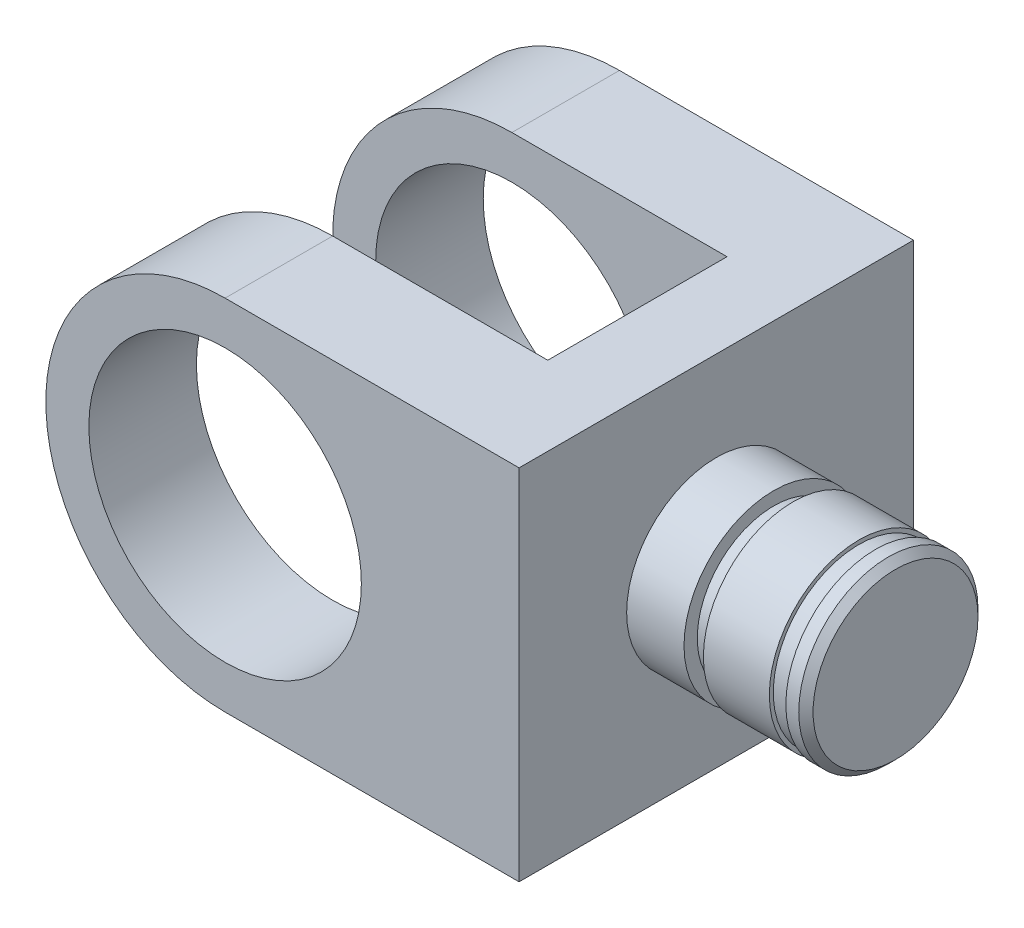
SolidWorks part; units mm, degrees
ref_plane "Face" through (0, 0, 0) normal (0, 0, 1) x (1, 0, 0)
ref_plane "Dessus" through (0, 0, 0) normal (0, 1, 0) x (1, 0, 0)
ref_plane "Droite" through (0, 0, 0) normal (1, 0, 0) x (0, 0, -1)
sketch "Esquisse1" plane through (0, 0, 0) normal (0, 0, 1) x (1, 0, 0)
  line L0 (-15.3524, 22.807) -> (-7.3524, 22.807)
  line L1 (9.6476, 10.307) -> (9.6476, 21.807)
  line L2 (21.1095, 10.307) -> (-49.652, 10.307) construction
  line L3 (-15.3524, 22.807) -> (-15.3524, 10.307)
  line L4 (6.8476, 22.807) -> (8.6476, 22.807)
  line L5 (9.6476, 21.807) -> (8.6476, 22.807)
  line L6 (4.5476, 22.807) -> (4.5476, 22.257)
  line L7 (4.5476, 22.257) -> (6.8476, 22.257)
  line L8 (6.8476, 22.807) -> (6.8476, 22.257)
  line L9 (9.6476, 10.307) -> (-15.3524, 10.307)
  line L10 (-4.6524, 22.807) -> (4.5476, 22.807)
  line L12 (-7.3524, 22.807) -> (-7.3524, 20.957)
  line L13 (-7.3524, 20.957) -> (-4.6524, 20.957)
  line L14 (-4.6524, 22.807) -> (-4.6524, 20.957)
  point P1 (9.6476, 22.807)
  dimension "D1" = 2.7
  dimension "D2" = 25
  dimension "D3" = 23.9
  dimension "D4" = 22.2
  dimension "D5" = 25
  dimension "D7" = 1
  dimension "D6" = 21.3
  dimension "D8" = 8
revolve "Révolution1" add sketch "Esquisse1" angle 360 about L2
sketch "Esquisse2" plane through (0, 0, 0) normal (0, 0, 1) x (1, 0, 0)
  line L0 (-15.3524, 22.807) -> (-15.3524, -2.193) construction
  line L1 (-56.3524, 35.307) -> (-15.3524, 35.307)
  line L3 (-56.3524, -14.693) -> (-15.3524, -14.693)
  line L4 (-15.3524, 35.307) -> (-15.3524, -14.693)
  line L5 (6.8476, 10.307) -> (-55.9529, 10.307) construction
  line L6 (6.8476, 22.257) -> (6.8476, -1.643) construction
  arc A0 (-56.3524, 35.307) -> (-56.3524, -14.693) centre (-56.3524, 10.307) ccw
  circle A1 centre (-56.3524, 10.307) radius 19
  dimension "D3" = 41
  dimension "D4" = 38
  dimension "D1" = 50
  dimension "D2" = 25
extrude "Extrusion1" add sketch "Esquisse2" along normal mid plane 55
sketch "Esquisse3" plane through (0, 0, 0) normal (0, 0, 1) x (1, 0, 0)
  line L0 (-15.3524, -14.693) -> (-15.3524, 35.307) construction
  line L1 (-84.4932, 42.2021) -> (-26.3524, 42.2021)
  line L2 (-84.4932, 42.2021) -> (-84.4932, -26.3217)
  line L3 (-84.4932, -26.3217) -> (-26.3524, -26.3217)
  line L4 (-26.3524, 42.2021) -> (-26.3524, -26.3217)
  dimension "D1" = 11
extrude "Enlèv. mat.-Extru.1" cut sketch "Esquisse3" against normal mid plane 25
